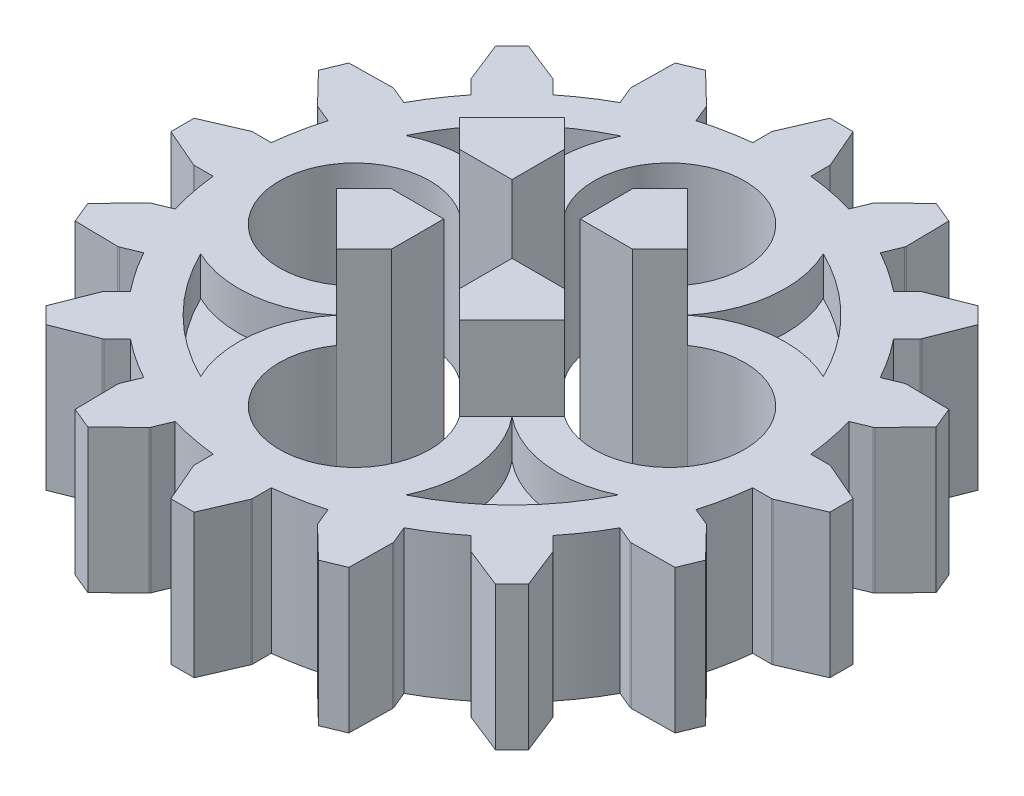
SolidWorks part; units mm, degrees
ref_plane "Front Plane" through (0, 0, 0) normal (0, 0, 1) x (1, 0, 0)
ref_plane "Top Plane" through (0, 0, 0) normal (0, 1, 0) x (1, 0, 0)
ref_plane "Right Plane" through (0, 0, 0) normal (1, 0, 0) x (0, 0, -1)
sketch "Sketch7" plane through (0, 0, 0) normal (0, 1, 0) x (1, 0, 0)
  line L0 (0, -9.3972) -> (0, 10.5294) construction
  line L1 (-0.3, 8.5) -> (0.3, 8.5)
  line L2 (0.75, 6.9597) -> (0.75, 7.439)
  line L3 (0.3, 8.5) -> (0.7418, 7.4787)
  line L4 (-0.75, 6.9597) -> (-0.75, 7.439)
  line L5 (-0.3, 8.5) -> (-0.7418, 7.4787)
  line L6 (1.9705, 6.7169) -> (2.1539, 7.1598)
  line L7 (2.9756, 7.9678) -> (2.1767, 7.1933)
  line L8 (2.9756, 7.9678) -> (3.53, 7.7382)
  line L9 (3.53, 7.7382) -> (3.5473, 6.6256)
  line L10 (3.3563, 6.1429) -> (3.5397, 6.5857)
  line L11 (4.3909, 5.4516) -> (4.7298, 5.7905)
  line L12 (5.7983, 6.2225) -> (4.7637, 5.8128)
  line L13 (5.7983, 6.2225) -> (6.2225, 5.7983)
  line L14 (6.2225, 5.7983) -> (5.8128, 4.7637)
  line L15 (5.4516, 4.3909) -> (5.7905, 4.7298)
  line L16 (6.1429, 3.3563) -> (6.5857, 3.5397)
  line L17 (7.7382, 3.53) -> (6.6256, 3.5473)
  line L18 (7.7382, 3.53) -> (7.9678, 2.9756)
  line L19 (7.9678, 2.9756) -> (7.1933, 2.1767)
  line L20 (6.7169, 1.9705) -> (7.1598, 2.1539)
  line L21 (6.9597, 0.75) -> (7.439, 0.75)
  line L22 (8.5, 0.3) -> (7.4787, 0.7418)
  line L23 (8.5, 0.3) -> (8.5, -0.3)
  line L24 (8.5, -0.3) -> (7.4787, -0.7418)
  line L25 (6.9597, -0.75) -> (7.439, -0.75)
  line L26 (6.7169, -1.9705) -> (7.1598, -2.1539)
  line L27 (7.9678, -2.9756) -> (7.1933, -2.1767)
  line L28 (7.9678, -2.9756) -> (7.7382, -3.53)
  line L29 (7.7382, -3.53) -> (6.6256, -3.5473)
  line L30 (6.1429, -3.3563) -> (6.5857, -3.5397)
  line L31 (5.4516, -4.3909) -> (5.7905, -4.7298)
  line L32 (6.2225, -5.7983) -> (5.8128, -4.7637)
  line L33 (6.2225, -5.7983) -> (5.7983, -6.2225)
  line L34 (5.7983, -6.2225) -> (4.7637, -5.8128)
  line L35 (4.3909, -5.4516) -> (4.7298, -5.7905)
  line L36 (3.3563, -6.1429) -> (3.5397, -6.5857)
  line L37 (3.53, -7.7382) -> (3.5473, -6.6256)
  line L38 (3.53, -7.7382) -> (2.9756, -7.9678)
  line L39 (2.9756, -7.9678) -> (2.1767, -7.1933)
  line L40 (1.9705, -6.7169) -> (2.1539, -7.1598)
  line L41 (0.75, -6.9597) -> (0.75, -7.439)
  line L42 (0.3, -8.5) -> (0.7418, -7.4787)
  line L43 (0.3, -8.5) -> (-0.3, -8.5)
  line L44 (-0.3, -8.5) -> (-0.7418, -7.4787)
  line L45 (-0.75, -6.9597) -> (-0.75, -7.439)
  line L46 (-1.9705, -6.7169) -> (-2.1539, -7.1598)
  line L47 (-2.9756, -7.9678) -> (-2.1767, -7.1933)
  line L48 (-2.9756, -7.9678) -> (-3.53, -7.7382)
  line L49 (-3.53, -7.7382) -> (-3.5473, -6.6256)
  line L50 (-3.3563, -6.1429) -> (-3.5397, -6.5857)
  line L51 (-4.3909, -5.4516) -> (-4.7298, -5.7905)
  line L52 (-5.7983, -6.2225) -> (-4.7637, -5.8128)
  line L53 (-5.7983, -6.2225) -> (-6.2225, -5.7983)
  line L54 (-6.2225, -5.7983) -> (-5.8128, -4.7637)
  line L55 (-5.4516, -4.3909) -> (-5.7905, -4.7298)
  line L56 (-6.1429, -3.3563) -> (-6.5857, -3.5397)
  line L57 (-7.7382, -3.53) -> (-6.6256, -3.5473)
  line L58 (-7.7382, -3.53) -> (-7.9678, -2.9756)
  line L59 (-7.9678, -2.9756) -> (-7.1933, -2.1767)
  line L60 (-6.7169, -1.9705) -> (-7.1598, -2.1539)
  line L61 (-6.9597, -0.75) -> (-7.439, -0.75)
  line L62 (-8.5, -0.3) -> (-7.4787, -0.7418)
  line L63 (-8.5, -0.3) -> (-8.5, 0.3)
  line L64 (-8.5, 0.3) -> (-7.4787, 0.7418)
  line L65 (-6.9597, 0.75) -> (-7.439, 0.75)
  line L66 (-6.7169, 1.9705) -> (-7.1598, 2.1539)
  line L67 (-7.9678, 2.9756) -> (-7.1933, 2.1767)
  line L68 (-7.9678, 2.9756) -> (-7.7382, 3.53)
  line L69 (-7.7382, 3.53) -> (-6.6256, 3.5473)
  line L70 (-6.1429, 3.3563) -> (-6.5857, 3.5397)
  line L71 (-5.4516, 4.3909) -> (-5.7905, 4.7298)
  line L72 (-6.2225, 5.7983) -> (-5.8128, 4.7637)
  line L73 (-6.2225, 5.7983) -> (-5.7983, 6.2225)
  line L74 (-5.7983, 6.2225) -> (-4.7637, 5.8128)
  line L75 (-4.3909, 5.4516) -> (-4.7298, 5.7905)
  line L76 (-3.3563, 6.1429) -> (-3.5397, 6.5857)
  line L77 (-3.53, 7.7382) -> (-3.5473, 6.6256)
  line L78 (-3.53, 7.7382) -> (-2.9756, 7.9678)
  line L79 (-2.9756, 7.9678) -> (-2.1767, 7.1933)
  line L80 (-1.9705, 6.7169) -> (-2.1539, 7.1598)
  circle A0 centre (0, 0) radius 7
  arc A2 (0.75, 7.439) -> (0.7418, 7.4787) centre (0.65, 7.439) ccw
  arc A3 (-0.75, 7.439) -> (-0.7418, 7.4787) centre (-0.65, 7.439) cw
  arc A4 (2.1539, 7.1598) -> (2.1767, 7.1933) centre (2.2463, 7.1215) cw
  arc A5 (3.5397, 6.5857) -> (3.5473, 6.6256) centre (3.4473, 6.624) ccw
  arc A6 (4.7298, 5.7905) -> (4.7637, 5.8128) centre (4.8006, 5.7198) cw
  arc A7 (5.7905, 4.7298) -> (5.8128, 4.7637) centre (5.7198, 4.8006) ccw
  arc A8 (6.5857, 3.5397) -> (6.6256, 3.5473) centre (6.624, 3.4473) cw
  arc A9 (7.1598, 2.1539) -> (7.1933, 2.1767) centre (7.1215, 2.2463) ccw
  arc A10 (7.439, 0.75) -> (7.4787, 0.7418) centre (7.439, 0.65) cw
  arc A11 (7.439, -0.75) -> (7.4787, -0.7418) centre (7.439, -0.65) ccw
  arc A12 (7.1598, -2.1539) -> (7.1933, -2.1767) centre (7.1215, -2.2463) cw
  arc A13 (6.5857, -3.5397) -> (6.6256, -3.5473) centre (6.624, -3.4473) ccw
  arc A14 (5.7905, -4.7298) -> (5.8128, -4.7637) centre (5.7198, -4.8006) cw
  arc A15 (4.7298, -5.7905) -> (4.7637, -5.8128) centre (4.8006, -5.7198) ccw
  arc A16 (3.5397, -6.5857) -> (3.5473, -6.6256) centre (3.4473, -6.624) cw
  arc A17 (2.1539, -7.1598) -> (2.1767, -7.1933) centre (2.2463, -7.1215) ccw
  arc A18 (0.75, -7.439) -> (0.7418, -7.4787) centre (0.65, -7.439) cw
  arc A19 (-0.75, -7.439) -> (-0.7418, -7.4787) centre (-0.65, -7.439) ccw
  arc A20 (-2.1539, -7.1598) -> (-2.1767, -7.1933) centre (-2.2463, -7.1215) cw
  arc A21 (-3.5397, -6.5857) -> (-3.5473, -6.6256) centre (-3.4473, -6.624) ccw
  arc A22 (-4.7298, -5.7905) -> (-4.7637, -5.8128) centre (-4.8006, -5.7198) cw
  arc A23 (-5.7905, -4.7298) -> (-5.8128, -4.7637) centre (-5.7198, -4.8006) ccw
  arc A24 (-6.5857, -3.5397) -> (-6.6256, -3.5473) centre (-6.624, -3.4473) cw
  arc A25 (-7.1598, -2.1539) -> (-7.1933, -2.1767) centre (-7.1215, -2.2463) ccw
  arc A26 (-7.439, -0.75) -> (-7.4787, -0.7418) centre (-7.439, -0.65) cw
  arc A27 (-7.439, 0.75) -> (-7.4787, 0.7418) centre (-7.439, 0.65) ccw
  arc A28 (-7.1598, 2.1539) -> (-7.1933, 2.1767) centre (-7.1215, 2.2463) cw
  arc A29 (-6.5857, 3.5397) -> (-6.6256, 3.5473) centre (-6.624, 3.4473) ccw
  arc A30 (-5.7905, 4.7298) -> (-5.8128, 4.7637) centre (-5.7198, 4.8006) cw
  arc A31 (-4.7298, 5.7905) -> (-4.7637, 5.8128) centre (-4.8006, 5.7198) ccw
  arc A32 (-3.5397, 6.5857) -> (-3.5473, 6.6256) centre (-3.4473, 6.624) cw
  arc A33 (-2.1539, 7.1598) -> (-2.1767, 7.1933) centre (-2.2463, 7.1215) ccw
  point P11 (0.75, 7.4597)
  point P17 (0, 8.5)
  point P170 (0, 0)
  dimension "D1" = 14
  dimension "D2" = 0.3
  dimension "D5" = 0.1
  dimension "D3" = 0.5
  dimension "D4" = 0.75
  dimension "D6" = 16
extrude "Boss-Extrude4" add sketch "Sketch7" along normal blind 3.7 contours A0 L0 | L0 A0 | L50 A21 L49 L48 L47 A20 L46 A0 | L55 A23 L54 L53 L52 A22 L51 A0 | L60 A25 L59 L58 L57 A24 L56 A0 | L65 A27 L64 L63 L62 A26 L61 A0 | L70 A29 L69 L68 L67 A28 L66 A0 | L75 A31 L74 L73 L72 A30 L71 A0 | L80 A33 L79 L78 L77 A32 L76 A0 | L10 A5 L9 L8 L7 A4 L6 A0 | L0 A0 L2 A2 L3 L1 | A0 L0 L1 L5 A3 L4 | L15 A7 L14 L13 L12 A6 L11 A0 | L20 A9 L19 L18 L17 A8 L16 A0 | L25 A11 L24 L23 L22 A10 L21 A0 | L30 A13 L29 L28 L27 A12 L26 A0 | L35 A15 L34 L33 L32 A14 L31 A0 | L40 A17 L39 L38 L37 A16 L36 A0 | L0 L43 L42 A18 L41 A0 | L43 L0 A0 L45 A19 L44
sketch "Sketch8" plane through (0, 0, 0) normal (0, 1, 0) x (1, 0, 0)
  line L0 (0.88, -2.23) -> (0.88, -0.88)
  line L1 (-0.88, 2.23) -> (-0.88, 0.88)
  line L2 (-2.23, 0.88) -> (-0.88, 0.88)
  line L3 (-2.23, -0.88) -> (-0.88, -0.88)
  line L4 (-0.88, 2.23) -> (0.88, 2.23)
  line L5 (2.23, 0.88) -> (2.23, -0.88)
  line L6 (-2.23, -0.88) -> (-2.23, 0.88)
  line L7 (-0.88, -2.23) -> (0.88, -2.23)
  line L8 (0.88, 0.88) -> (0.88, 2.23)
  line L9 (0.88, 0.88) -> (2.23, 0.88)
  line L10 (-0.88, -0.88) -> (-0.88, -2.23)
  line L11 (0.88, -0.88) -> (2.23, -0.88)
  dimension "D1" = 1.76
  dimension "D2" = 1.76
  dimension "D3" = 0.88
  dimension "D4" = 0.88
  dimension "D5" = 1.35
  dimension "D6" = 1.35
  dimension "D7" = 1.35
  dimension "D8" = 1.35
extrude "Cut-Extrude1" cut sketch "Sketch8" along normal blind 4
ref_plane "MidPlane" through (0, 1.85, 0) normal (0, 1, 0) x (1, 0, 0)
sketch "Sketch9" plane through (0, 1.85, 0) normal (0, 1, 0) x (1, 0, 0)
  line L0 (-2.23, 0.88) -> (-2.9371, 1.5871)
  line L1 (-0.88, 2.23) -> (-1.5871, 2.9371)
  line L2 (-2.9371, 1.5871) -> (-1.5871, 2.9371)
  line L3 (-2.23, 0.88) -> (-0.88, 0.88)
  line L4 (-0.88, 0.88) -> (-0.88, 2.23)
  line L5 (0.88, 0.88) -> (2.23, 0.88)
  line L6 (2.23, 0.88) -> (2.9371, 1.5871)
  line L7 (1.5871, 2.9371) -> (2.9371, 1.5871)
  line L8 (0.88, 2.23) -> (1.5871, 2.9371)
  line L9 (0.88, 2.23) -> (0.88, 0.88)
  line L10 (0.88, -0.88) -> (0.88, -2.23)
  line L11 (0.88, -2.23) -> (1.5871, -2.9371)
  line L12 (2.9371, -1.5871) -> (1.5871, -2.9371)
  line L13 (2.23, -0.88) -> (2.9371, -1.5871)
  line L14 (2.23, -0.88) -> (0.88, -0.88)
  line L15 (-0.88, -0.88) -> (-2.23, -0.88)
  line L16 (-2.23, -0.88) -> (-2.9371, -1.5871)
  line L17 (-1.5871, -2.9371) -> (-2.9371, -1.5871)
  line L18 (-0.88, -2.23) -> (-1.5871, -2.9371)
  line L19 (-0.88, -2.23) -> (-0.88, -0.88)
  point P26 (0, 0)
  dimension "D1" = 1
  dimension "D2" = 1
  dimension "D3" = 4
extrude "Boss-Extrude5" add sketch "Sketch9" along normal blind 4 and the other way blind 4
sketch "Sketch10" plane through (0, 3.7, 0) normal (0, 1, 0) x (1, 0, 0)
  line L0 (-1.5871, 2.9371) -> (-2.9371, 1.5871) construction
  line L1 (2.9371, 1.5871) -> (1.5871, 2.9371) construction
  line L2 (-2.9371, -1.5871) -> (-1.5871, -2.9371) construction
  line L3 (1.5871, -2.9371) -> (2.9371, -1.5871) construction
  arc A0 (-6, 0) -> (0, 6) centre (0, 0) ccw
  arc A1 (-1.5871, 2.9371) -> (1.5871, 2.9371) centre (0, 4.0574) cw
  arc A2 (2.9371, 1.5871) -> (2.9371, -1.5871) centre (4.0574, 0) cw
  arc A3 (1.5871, -2.9371) -> (-1.5871, -2.9371) centre (0, -4.0574) cw
  arc A4 (-2.9371, 1.5871) -> (-2.9371, -1.5871) centre (-4.0574, 0) ccw
  arc A5 (-2.2621, 2.2621) -> (-2.5922, 5.4112) centre (0, 4.091) cw
  arc A6 (-2.2621, -2.2621) -> (-2.6471, -5.3845) centre (0, -4.1259) ccw
  arc A7 (2.2621, 2.2621) -> (5.3871, 2.6419) centre (4.1226, 0) cw
  arc A8 (-2.2621, 2.2621) -> (-5.3858, 2.6445) centre (-4.1243, 0) ccw
  arc A9 (-2.2621, 2.2621) -> (-2.5922, 5.4112) centre (0, 4.091) cw
  arc A10 (-5.3858, -2.6445) -> (-2.2621, -2.2621) centre (-4.1243, 0) ccw
  arc A11 (-2.5922, 5.4112) -> (-5.3862, 2.6437) centre (0, 0) ccw
  arc A12 (2.5922, 5.4112) -> (2.2621, 2.2621) centre (0, 4.091) cw
  arc A13 (5.3871, -2.6419) -> (2.2621, -2.2621) centre (4.1226, 0) cw
  arc A14 (2.6471, -5.3845) -> (2.2621, -2.2621) centre (0, -4.1259) ccw
  arc A15 (5.4112, 2.5922) -> (2.6437, 5.3862) centre (0, 0) ccw
  arc A16 (2.2621, 2.2621) -> (5.4112, 2.5922) centre (4.091, 0) cw
  arc A17 (2.2621, 2.2621) -> (2.6445, 5.3858) centre (0, 4.1243) ccw
  arc A18 (2.5922, -5.4112) -> (5.3862, -2.6437) centre (0, 0) ccw
  arc A19 (2.2621, -2.2621) -> (2.5922, -5.4112) centre (0, -4.091) cw
  arc A20 (2.2621, -2.2621) -> (5.3858, -2.6445) centre (4.1243, 0) ccw
  arc A21 (-5.4112, -2.5922) -> (-2.6437, -5.3862) centre (0, 0) ccw
  arc A22 (-2.2621, -2.2621) -> (-5.4112, -2.5922) centre (-4.091, 0) cw
  arc A23 (-2.2621, -2.2621) -> (-2.6445, -5.3858) centre (0, -4.1243) ccw
  arc A24 (-2.9371, 1.5871) -> (-2.9371, -1.5871) centre (-4.0574, 0) ccw
  arc A25 (1.5871, 2.9371) -> (-1.5871, 2.9371) centre (0, 4.0574) ccw
  arc A26 (2.9371, -1.5871) -> (2.9371, 1.5871) centre (4.0574, 0) ccw
  arc A27 (-1.5871, -2.9371) -> (1.5871, -2.9371) centre (0, -4.0574) ccw
  spline S0 degree 3 poles (-2.2621, 2.2621) (-2.4899, 2.4498) (-2.9371, 2.7161) (-3.6913, 2.9281) (-4.5094, 2.9511) (-5.0891, 2.7845) (-5.3862, 2.6437) knots 0 0 0 0 0.177707 0.30827 0.467704 0.663979 0.663979 0.663979 0.663979
  spline S1 degree 3 poles (-2.5922, 5.4112) (-3.0663, 5.1842) (-3.8133, 4.6965) (-4.7476, 3.7356) (-5.1858, 3.0513) (-5.384, 2.648) knots 0 0 0 0 0.394361 0.662932 1 1 1 1
  point P80 (0, 0)
  point P91 (0, 0)
  dimension "D1" = 12
  dimension "D2" = 4
  dimension "D3" = 4
extrude "Cut-Extrude2" cut sketch "Sketch10" against normal blind 1 contours S0 A5 A11 A8 | A17 A7 A0 | A20 A14 A0 | A10 A0 A6
sketch "Sketch13" plane through (0, 3.7, 0) normal (0, 1, 0) x (1, 0, 0)
  line L0 (-2.9371, 1.5871) -> (-2.23, 0.88)
  line L1 (-2.23, 0.88) -> (-2.23, -0.88)
  line L2 (-2.23, -0.88) -> (-2.9371, -1.5871)
  line L3 (-0.88, 2.23) -> (-1.5871, 2.9371)
  line L4 (1.5871, 2.9371) -> (0.88, 2.23)
  line L5 (0.88, 2.23) -> (-0.88, 2.23)
  line L6 (2.23, 0.88) -> (2.9371, 1.5871)
  line L7 (2.9371, -1.5871) -> (2.23, -0.88)
  line L8 (2.23, -0.88) -> (2.23, 0.88)
  line L9 (0.88, -2.23) -> (1.5871, -2.9371)
  line L10 (-1.5871, -2.9371) -> (-0.88, -2.23)
  line L11 (-0.88, -2.23) -> (0.88, -2.23)
  arc A0 (-2.9371, 1.5871) -> (-2.9371, -1.5871) centre (-4.0574, 0) ccw
  arc A1 (1.5871, 2.9371) -> (-1.5871, 2.9371) centre (0, 4.0574) ccw
  arc A2 (2.9371, -1.5871) -> (2.9371, 1.5871) centre (4.0574, 0) ccw
  arc A3 (-1.5871, -2.9371) -> (1.5871, -2.9371) centre (0, -4.0574) ccw
  point P28 (0, 0)
  dimension "D1" = 4
extrude "Cut-Extrude3" cut sketch "Sketch13" against normal blind 4
mirror "Mirror4" about plane through (0, 1.85, 0) normal (0, 1, 0) of "Cut-Extrude2"
